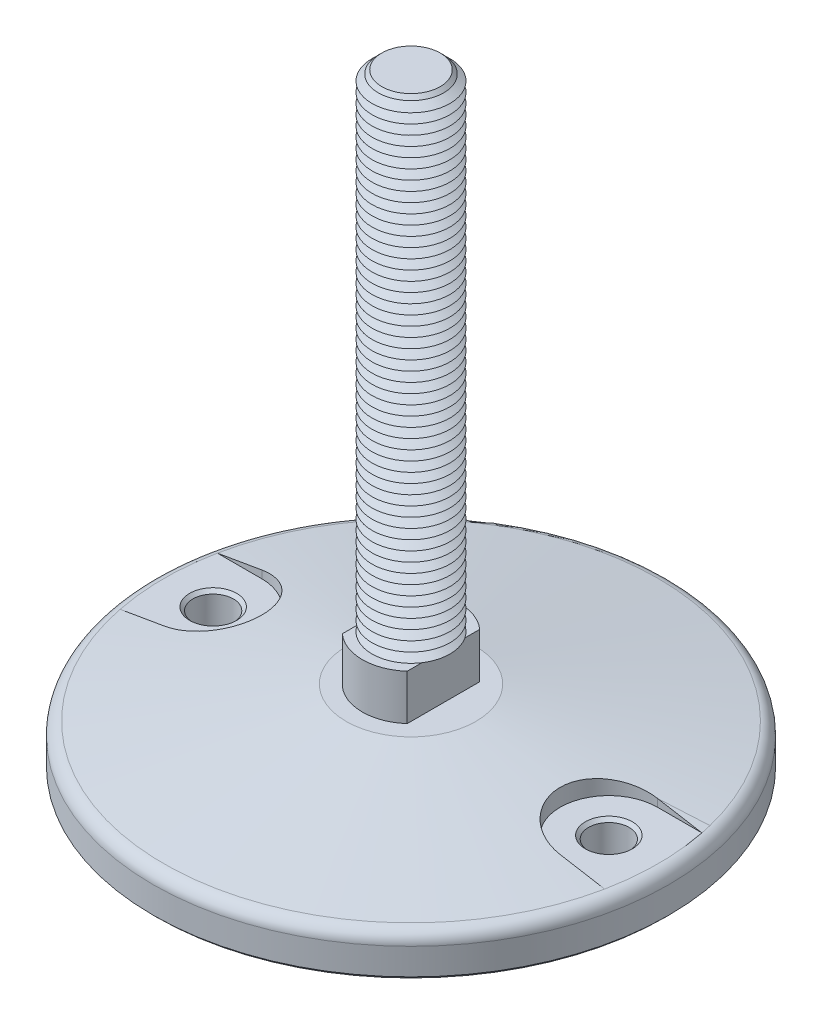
SolidWorks part; units mm, degrees
ref_plane "Front Plane" through (0, 0, 0) normal (0, 0, 1) x (1, 0, 0)
ref_plane "Top Plane" through (0, 0, 0) normal (0, 1, 0) x (1, 0, 0)
ref_plane "Right Plane" through (0, 0, 0) normal (1, 0, 0) x (0, 0, -1)
sketch "Sketch1" plane through (0, 0, 0) normal (1, 0, 0) x (0, 0, -1)
  line L0 (0, 61.3389) -> (0, -58.404) construction
sketch "Sketch2" plane through (0, 0, 0) normal (1, 0, 0) x (0, 0, -1)
  line L0 (0, 0) -> (-20, 0)
  line L1 (-20, 0) -> (-79.5, -10.4915)
  line L2 (-79.5, -10.4915) -> (-79.5, -23)
  line L3 (-79.5, -23) -> (0, -23)
  line L4 (0, 61.3389) -> (0, -58.404) construction
  line L5 (0, -23) -> (0, 0)
  dimension "D1" = 23
  dimension "D2" = 79.5
  dimension "D3" = 20
  dimension "D4" = 10
revolve "Revolve1" add sketch "Sketch2" angle 360 about L0
fillet "Fillet1" radius 4 1 edges at (0, -10.4915, 79.5)
sketch "Sketch3" plane through (0, 0, 0) normal (0, 1, 0) x (1, 0, 0)
  circle A0 centre (0, 0) radius 15
  dimension "D1" = 30
extrude "Boss-Extrude1" add sketch "Sketch3" along normal blind 14
sketch "Sketch4" plane through (0, 14, 0) normal (0, 1, 0) x (1, 0, 0)
  line L0 (-10, 11.1803) -> (-10, -11.1803)
  line L2 (10, -11.1803) -> (10, 11.1803)
  arc A0 (-10, 11.1803) -> (-10, -11.1803) centre (0, 0) ccw
  circle A1 centre (0, 0) radius 15 construction
  arc A2 (10, -11.1803) -> (10, 11.1803) centre (0, 0) ccw
  dimension "D1" = 20
extrude "Cut-Extrude1" cut sketch "Sketch4" against normal blind 14
sketch "Sketch5" plane through (0, 14, 0) normal (0, 1, 0) x (1, 0, 0)
  circle A0 centre (0, 0) radius 12
  dimension "D1" = 24
extrude "Boss-Extrude2" add sketch "Sketch5" along normal blind 150
chamfer "Chamfer1" distance 3 angle 45 1 edges at (0, 164, 12)
sketch "Sketch6" plane through (0, 0, 0) normal (1, 0, 0) x (0, 0, -1)
  line L0 (-12, 14) -> (-9.4019, 15.5)
  line L1 (-9.4019, 15.5) -> (-12, 17)
  line L2 (-12, 161) -> (-12, 14) construction
  line L3 (-12, 17) -> (-12, 14)
  dimension "D1" = 3
revolve "Cut-Revolve1" cut sketch "Sketch6" angle 360 about L0
pattern_linear "LPattern1" count 50 spacing 3 along (0, 1, 0) of "Cut-Revolve1"
sketch "Sketch8" plane through (0, 0, 0) normal (0, 1, 0) x (1, 0, 0)
  line L0 (-61, 15) -> (-74.7035, 15)
  line L1 (-61, -15) -> (-74.7035, -15)
  arc A1 (-74.7035, 15) -> (-74.7035, -15) centre (0, 0) ccw
  circle A2 centre (0, 0) radius 76.1946 construction
  arc A3 (-61, -15) -> (-61, 15) centre (-61, 0) ccw
  point P3 (-61, 0)
  point P11 (0, 0)
  dimension "D1" = 61
  dimension "D2" = 30
extrude "Cut-Extrude4" cut sketch "Sketch8" against normal blind 9.91
sketch "Sketch10" plane through (0, -9.91, 0) normal (0, 1, 0) x (1, 0, 0)
  circle A0 centre (-61, 0) radius 6.25
  dimension "D1" = 12.5
extrude "Cut-Extrude5" cut sketch "Sketch10" against normal up to surface (13.09 mm away)
chamfer "Chamfer2" distance 1 angle 45 2 edges at (-61, -23, -6.25) (-61, -9.91, 6.25)
mirror "Mirror1" about plane through (0, 0, 0) normal (1, 0, 0) of "Chamfer2", "Cut-Extrude5", "Cut-Extrude4"
chamfer "Chamfer3" distance 1 angle 45 1 edges at (0, -23, 79.5)
